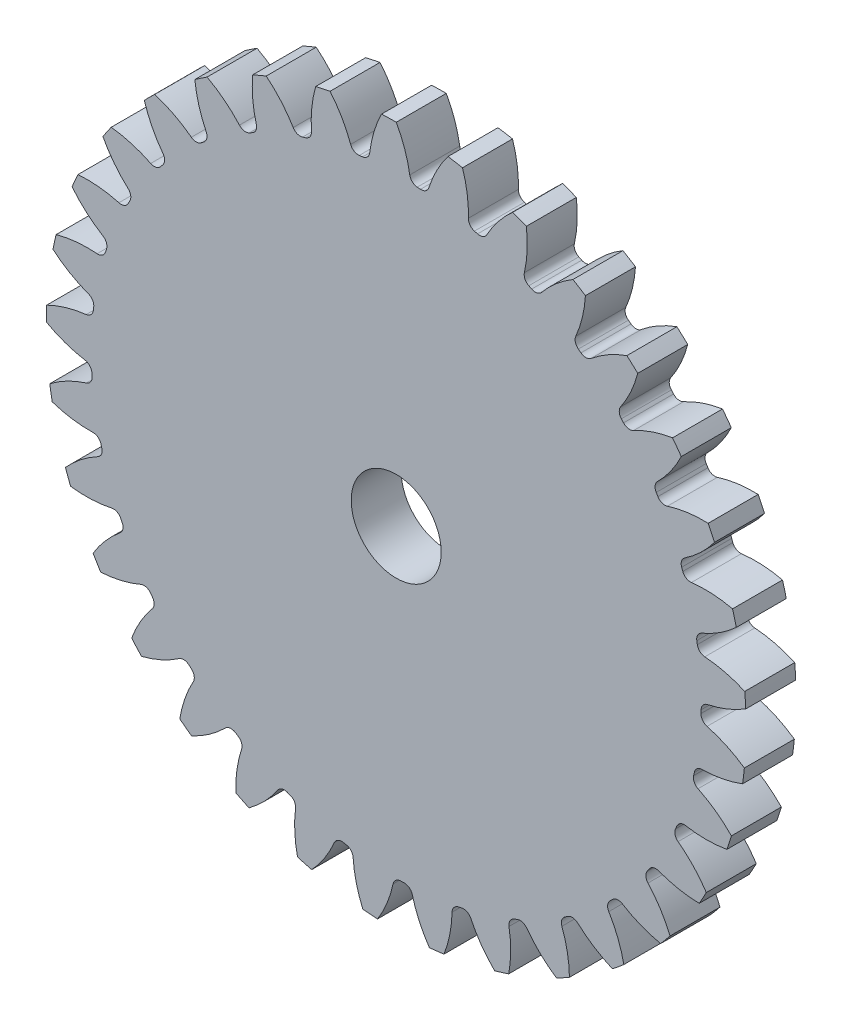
SolidWorks part; units mm, degrees
ref_plane "Front" through (0, 0, 0) normal (0, 0, 1) x (1, 0, 0)
ref_plane "Top" through (0, 0, 0) normal (0, 1, 0) x (1, 0, 0)
ref_plane "Right" through (0, 0, 0) normal (1, 0, 0) x (0, 0, -1)
sketch "Sketch3" plane through (0, 0, 0) normal (0, 0, 1) x (1, 0, 0)
  circle A0 centre (0, 0) radius 889
  dimension "od" = 1778
extrude "gearBody" add sketch "Sketch3" along normal blind 127
sketch "Sketch2" plane through (0, 0, 0) normal (0, 0, 1) x (1, 0, 0)
  line L0 (0, 0) -> (727.694, 301.4207) construction
  line L1 (885.4368, -90.2662) -> (0, 0) construction
  line L2 (0, 0) -> (36.3143, 0) construction
  line L3 (838.0232, 17.2174) -> (835.8988, -62.0673) construction
  line L5 (836.961, -22.425) -> (0, 0) construction
  line L7 (0, 0) -> (787.6504, 0) construction
  arc A0 (787.6464, 2.5064) -> (786.3821, -44.6799) centre (0, 0) ccw construction
  arc A1 (888.0024, 42.1038) -> (884.4738, -89.5943) centre (0, 0) ccw construction
  arc A2 (838.0232, 17.2174) -> (835.8988, -62.0673) centre (0, 0) ccw construction
  arc A3 (774.2999, -24.8937) -> (774.522, -16.6044) centre (0, 0) ccw
  arc A4 (885.4368, -90.2662) -> (789.601, -45.5258) centre (710.5094, -339.955) ccw
  arc A5 (885.4368, -90.2662) -> (889, 42.7231) centre (0, 0) ccw
  arc A6 (889, 42.7231) -> (790.906, 3.1787) centre (727.694, 301.4207) cw
  arc A7 (774.522, -16.6044) -> (790.906, 3.1787) centre (795.1929, -17.0476) cw
  arc A8 (789.601, -45.5258) -> (774.2999, -24.8937) centre (794.9649, -25.558) cw
  point P6 (889, 42.7231)
  point P22 (885.4368, -90.2662)
  dimension "baseDia" = 1575.3007
  dimension "od" = 1778
  dimension "pd" = 1676.4
  dimension "rd" = 1549.4
  dimension "rFillet" = 20.6756
  dimension "pointX" = 889
  dimension "pointY" = 42.7231
  dimension "CTT" = 79.2847
  dimension "flankCenterAngle" = 22.5
extrude "toothCut" cut sketch "Sketch2" along normal through all
pattern_circular "CirPattern1" count 33 over 360 about axis through (0, 0, 0) along (0, 0, 1) of "toothCut"
sketch "hub1Dia" plane through (0, 0, 0) normal (0, 0, -1) x (-1, 0, 0)
  circle A0 centre (0, 0) radius 12.7
  dimension "hub1Dia" = 25.4
sketch "hub2Dia" plane through (0, 0, 127) normal (0, 0, 1) x (1, 0, 0)
  circle A0 centre (0, 0) radius 12.7
  dimension "hub2dia" = 25.4
sketch "boreDia" plane through (0, 0, 0) normal (0, 0, 1) x (1, 0, 0)
  circle A0 centre (0, 0) radius 114.3
  dimension "boreDia" = 228.6
extrude "bore" cut sketch "boreDia" against normal mid plane 25400
